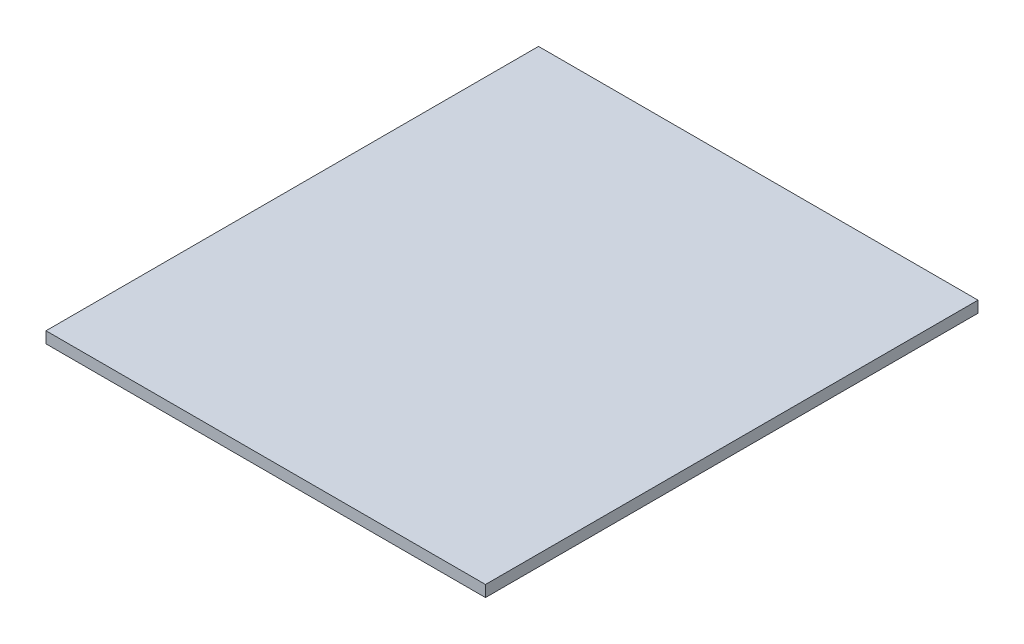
SolidWorks part; units mm, degrees
ref_plane "Face" through (0, 0, 0) normal (0, 0, 1) x (1, 0, 0)
ref_plane "Dessus" through (0, 0, 0) normal (0, 1, 0) x (1, 0, 0)
ref_plane "Droite" through (0, 0, 0) normal (1, 0, 0) x (0, 0, -1)
sketch "Esquisse1" plane through (0, 0, 0) normal (0, 0, 1) x (1, 0, 0)
  line L1 (-65.6351, -2.642) -> (50.3649, -2.642)
  line L2 (-65.6351, -2.642) -> (-65.6351, -5.642)
  line L3 (-65.6351, -5.642) -> (50.3649, -5.642)
  line L4 (50.3649, -2.642) -> (50.3649, -5.642)
  dimension "D1" = 3
  dimension "D2" = 116
extrude "Base-Extrusion" add sketch "Esquisse1" along normal blind 130
